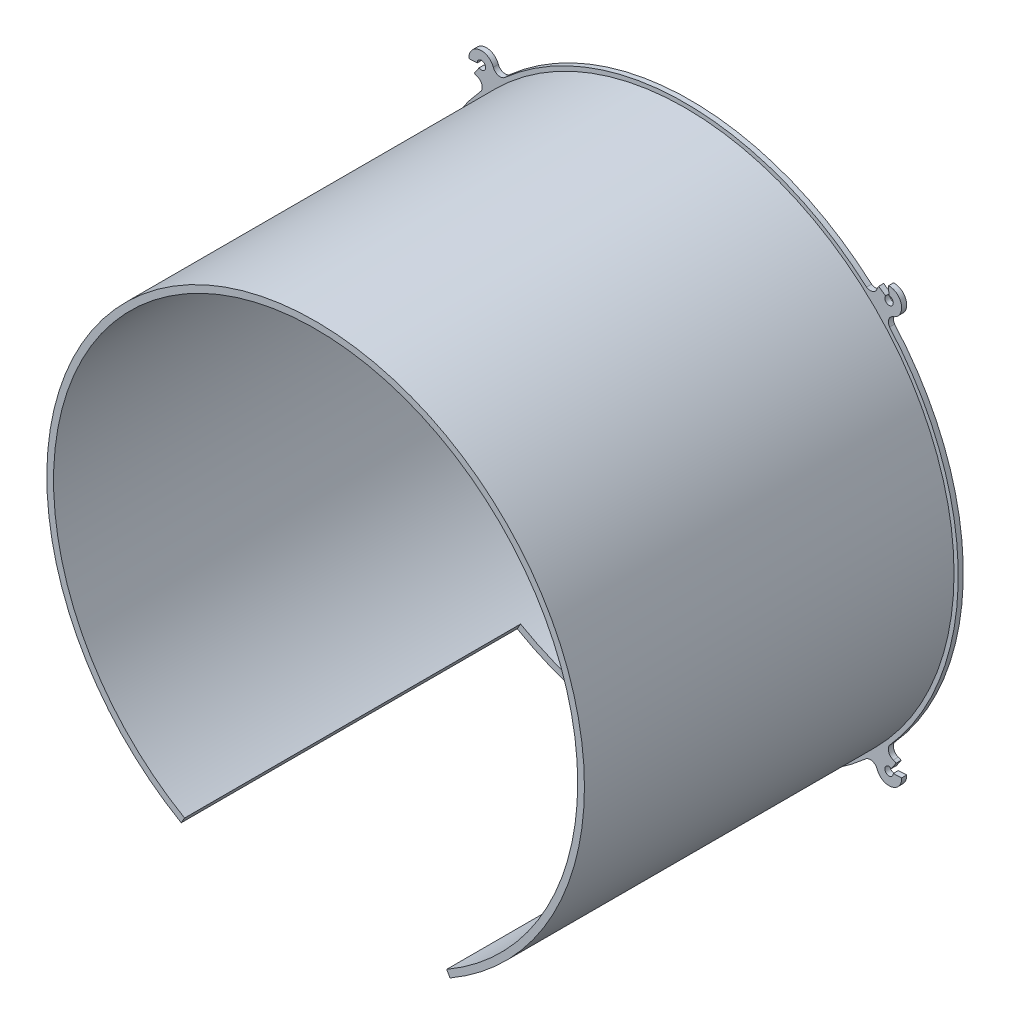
SolidWorks part; units mm, degrees
ref_plane "Alzado" through (0, 0, 0) normal (0, 0, 1) x (1, 0, 0)
ref_plane "Planta" through (0, 0, 0) normal (0, 1, 0) x (1, 0, 0)
ref_plane "Vista lateral" through (0, 0, 0) normal (1, 0, 0) x (0, 0, -1)
sketch "Croquis1" plane through (0, 0, 0) normal (0, 0, 1) x (1, 0, 0)
  line L0 (121.2128, 123.8145) -> (121.005, 128.8101)
  line L1 (119.2458, 122.7173) -> (115.1042, 125.5185)
  line L2 (123.8145, -121.2128) -> (128.8101, -121.005)
  line L3 (122.7173, -119.2458) -> (125.5185, -115.1042)
  line L4 (-121.2128, -123.8145) -> (-121.005, -128.8101)
  line L5 (-119.2458, -122.7173) -> (-115.1042, -125.5185)
  line L6 (-123.8145, 121.2128) -> (-128.8101, 121.005)
  line L7 (-122.7173, 119.2458) -> (-125.5185, 115.1042)
  arc A0 (123.8157, 114.2452) -> (121.6341, 107.7562) centre (125.264, 110.1471) ccw
  arc A1 (123.8157, 114.2452) -> (121.005, 128.8101) centre (121.3166, 121.3166) ccw
  arc A2 (114.2452, -123.8157) -> (107.7562, -121.6341) centre (110.1471, -125.264) ccw
  circle A3 centre (0, 0) radius 159.2769
  arc A4 (119.2458, 122.7173) -> (121.2128, 123.8145) centre (121.3166, 121.3166) ccw
  arc A5 (115.1042, 125.5185) -> (114.2452, 123.8157) centre (121.3166, 121.3166) ccw
  arc A6 (107.9083, 121.4992) -> (-107.7562, 121.6341) centre (0, 0) ccw
  arc A7 (107.9083, 121.4992) -> (114.2452, 123.8157) centre (110.1512, 125.1894) ccw
  arc A8 (114.2452, -123.8157) -> (128.8101, -121.005) centre (121.3166, -121.3166) ccw
  arc A9 (122.7173, -119.2458) -> (123.8145, -121.2128) centre (121.3166, -121.3166) ccw
  arc A10 (125.5185, -115.1042) -> (123.8157, -114.2452) centre (121.3166, -121.3166) ccw
  arc A11 (121.4992, -107.9083) -> (123.8157, -114.2452) centre (125.1894, -110.1512) ccw
  arc A12 (-123.8157, -114.2452) -> (-121.6341, -107.7562) centre (-125.264, -110.1471) ccw
  arc A13 (-123.8157, -114.2452) -> (-121.005, -128.8101) centre (-121.3166, -121.3166) ccw
  arc A14 (-119.2458, -122.7173) -> (-121.2128, -123.8145) centre (-121.3166, -121.3166) ccw
  arc A15 (-115.1042, -125.5185) -> (-114.2452, -123.8157) centre (-121.3166, -121.3166) ccw
  arc A16 (-107.9083, -121.4992) -> (-114.2452, -123.8157) centre (-110.1512, -125.1894) ccw
  arc A17 (-114.2452, 123.8157) -> (-107.7562, 121.6341) centre (-110.1471, 125.264) ccw
  arc A18 (-114.2452, 123.8157) -> (-128.8101, 121.005) centre (-121.3166, 121.3166) ccw
  arc A19 (-122.7173, 119.2458) -> (-123.8145, 121.2128) centre (-121.3166, 121.3166) ccw
  arc A20 (-125.5185, 115.1042) -> (-123.8157, 114.2452) centre (-121.3166, 121.3166) ccw
  arc A21 (-121.4992, 107.9083) -> (-123.8157, 114.2452) centre (-125.1894, 110.1512) ccw
  arc A22 (-121.4992, 107.9083) -> (-121.6341, -107.7562) centre (0, 0) ccw
  arc A23 (-107.9083, -121.4992) -> (107.7562, -121.6341) centre (0, 0) ccw
  arc A24 (121.4992, -107.9083) -> (121.6341, 107.7562) centre (0, 0) ccw
  dimension "D1" = 4
extrude "Saliente-Extruir1" add sketch "Croquis1" along normal blind 3
sketch "Croquis2" plane through (0, 0, 3) normal (0, 0, 1) x (1, 0, 0)
  circle A0 centre (0, 0) radius 160
  circle A1 centre (0, 0) radius 156
  dimension "D2" = 312
extrude "Saliente-Extruir2" add sketch "Croquis2" along normal blind 220 and the other way blind 3
sketch "Croquis3" plane through (0, 0, 223) normal (0, 0, 1) x (1, 0, 0)
  line L0 (0, 0) -> (0, -177.154) construction
  line L1 (0, 0) -> (-80, -138.5641)
  line L2 (0, 0) -> (80, -138.5641)
  arc A0 (-80, -138.5641) -> (80, -138.5641) centre (0, 0) ccw
  dimension "D1" = 30
  dimension "D2" = 30
extrude "Cortar-Extruir1" cut sketch "Croquis3" against normal blind 200
